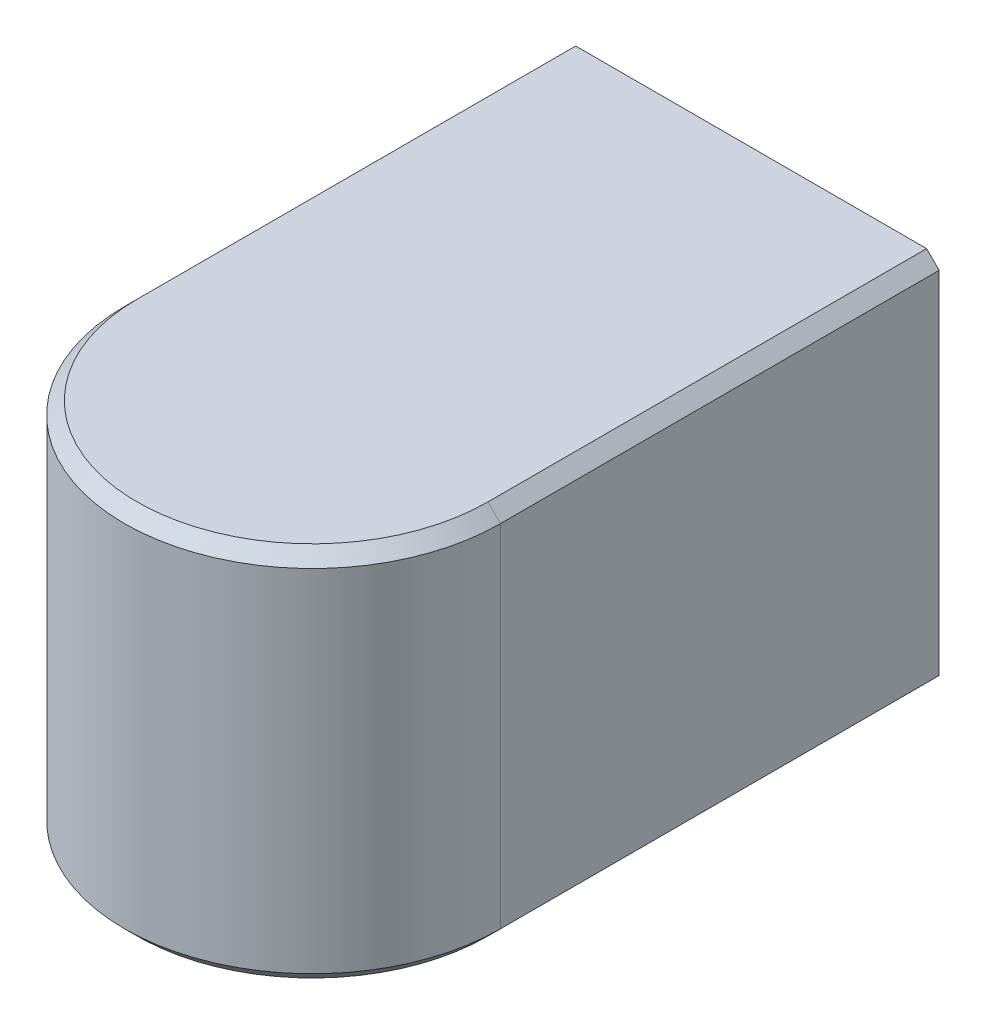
SolidWorks part; units mm, degrees
ref_plane "Face" through (0, 0, 0) normal (0, 0, 1) x (1, 0, 0)
ref_plane "Dessus" through (0, 0, 0) normal (0, 1, 0) x (1, 0, 0)
ref_plane "Droite" through (0, 0, 0) normal (1, 0, 0) x (0, 0, -1)
sketch "Esquisse1" plane through (0, 0, 0) normal (0, 0, 1) x (1, 0, 0)
  line L0 (-3, -3) -> (3, 3) construction
  line L1 (-3, -3) -> (3, -3)
  line L2 (-3, -3) -> (-3, 3)
  line L3 (-3, 3) -> (3, 3)
  line L4 (3, -3) -> (3, 3)
  dimension "D1" = 6
extrude "Extrusion1" add sketch "Esquisse1" along normal mid plane 7
sketch "Esquisse2" plane through (0, 3, 0) normal (0, 1, 0) x (-1, 0, 0)
  line L0 (-3, 3.5) -> (3, 3.5) construction
  line L1 (-3, 3.5) -> (3, 3.5)
  arc A0 (-3, 3.5) -> (3, 3.5) centre (0, 3.5) cw
extrude "Extrusion2" add sketch "Esquisse2" against normal up to vertex (6 mm away)
chamfer "Chanfrein2" distance 0.2 angle 45 3 edges at (3, 3, 0) (0, 3, 6.5) (-3, 3, 0)
chamfer "Chanfrein3" distance 0.2 angle 45 3 edges at (3, -3, 0) (0, -3, 6.5) (-3, -3, 0)
